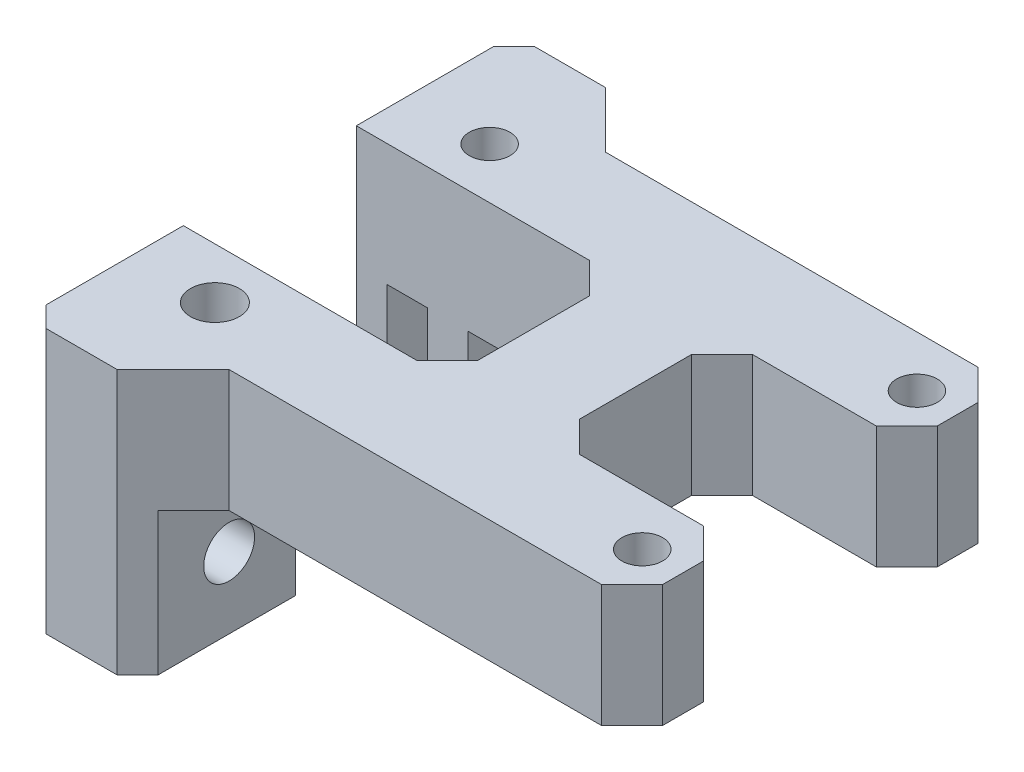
SolidWorks part; units mm, degrees
ref_plane "Front Plane" through (0, 0, 0) normal (0, 0, 1) x (1, 0, 0)
ref_plane "Top Plane" through (0, 0, 0) normal (0, 1, 0) x (1, 0, 0)
ref_plane "Right Plane" through (0, 0, 0) normal (1, 0, 0) x (0, 0, -1)
sketch "Sketch1" plane through (0, 0, 0) normal (0, 1, 0) x (1, 0, 0)
  line L0 (-9.58, 6.75) -> (9.58, 6.75) construction
  line L1 (9.58, 6.75) -> (9.58, -6.75) construction
  line L2 (0, 0) -> (50000, 0) construction
  line L3 (0, 0) -> (0, 50000) construction
  line L4 (-10.08, 4.25) -> (-4, 4.25)
  line L5 (-2.5, 2.75) -> (-2.5, -2.75)
  line L6 (-4, -4.25) -> (-10.08, -4.25)
  line L7 (10.08, 4.25) -> (4, 4.25)
  line L8 (2.5, 2.75) -> (2.5, -2.75)
  line L9 (4, -4.25) -> (10.08, -4.25)
  line L10 (-2.5, 0) -> (2.5, 0) construction
  line L11 (-10.08, 9.25) -> (10.08, 9.25)
  line L12 (-10.08, -9.25) -> (10.08, -9.25)
  line L13 (10.08, 9.25) -> (11.58, 7.75)
  line L14 (11.58, 7.75) -> (11.58, 5.75)
  line L15 (11.58, 5.75) -> (10.08, 4.25)
  line L16 (10.08, -4.25) -> (11.58, -5.75)
  line L17 (11.58, -5.75) -> (11.58, -7.75)
  line L18 (11.58, -7.75) -> (10.08, -9.25)
  line L19 (2.5, 2.75) -> (4, 4.25)
  line L20 (4, -4.25) -> (2.5, -2.75)
  line L21 (-4, -4.25) -> (-2.5, -2.75)
  line L22 (-4, 4.25) -> (-2.5, 2.75)
  line L23 (-11.58, 7.75) -> (-11.58, 5.75)
  line L24 (-11.58, -5.75) -> (-11.58, -7.75)
  line L25 (-11.58, 5.75) -> (-10.08, 4.25)
  line L26 (-11.58, -5.75) -> (-10.08, -4.25)
  line L27 (-11.58, 7.75) -> (-10.08, 9.25)
  line L28 (-11.58, -7.75) -> (-10.08, -9.25)
  circle A0 centre (-9.58, 6.75) radius 1 construction
  circle A1 centre (9.58, 6.75) radius 1 construction
  circle A2 centre (-9.58, -6.75) radius 1 construction
  circle A3 centre (9.58, -6.75) radius 1 construction
  circle A4 centre (9.58, 6.75) radius 1
  circle A5 centre (9.58, -6.75) radius 1
  point P13 (0, 6.75)
  point P14 (9.58, 0)
  point P25 (0, 0)
  point P30 (0, -9.25)
  point P31 (0, 9.25)
  dimension "D1" = 13.5
  dimension "D2" = 19.16
  dimension "D3" = 2
  dimension "D4" = 5
  dimension "D6" = 2.5
  dimension "D9" = 135
  dimension "D14" = 135
  dimension "D8" = 2
  dimension "D5" = 5
  dimension "D7" = 5
  dimension "D10" = 2
  dimension "D11" = 135
  dimension "D12" = 1.5
  dimension "D13" = 1.5
  dimension "D16" = 135
  dimension "D17" = 1.5
extrude "Boss-Extrude4" add sketch "Sketch1" along normal blind 6
sketch "Sketch11" plane through (0, 0, 0) normal (0, -1, 0) x (1, 0, 0)
  line L0 (-11.97, 10) -> (-11.97, -10) construction
  line L1 (-13.97, 10) -> (-13.97, -10) construction
  line L2 (-15.47, 10) -> (-15.47, -10) construction
  line L3 (-9.97, 10) -> (-9.97, -10) construction
  line L4 (-11.58, -7.75) -> (-11.58, -5.75) construction
  line L6 (0, 0) -> (-50000, 0) construction
  line L7 (-9.97, 4.25) -> (-11.97, 4.25)
  line L8 (-9.97, -4.25) -> (-11.97, -4.25)
  line L9 (-10.97, 4.25) -> (-10.97, -4.25) construction
  line L10 (-13.97, 10) -> (-11.97, 10)
  line L11 (-11.97, -10) -> (-13.97, -10)
  line L12 (-11.97, -4.25) -> (-11.97, -10)
  line L13 (-11.97, 10) -> (-11.97, 4.25)
  line L14 (-13.97, 10) -> (-13.97, 4.25)
  line L15 (-13.97, 4.25) -> (-15.47, 4.25)
  line L16 (-13.97, -10) -> (-13.97, -4.25)
  line L17 (-13.97, -4.25) -> (-15.47, -4.25)
  line L18 (-14.47, 12) -> (-10.97, 12)
  line L19 (-14.47, -12) -> (-10.97, -12)
  line L20 (-15.47, 11) -> (-15.47, 4.25)
  line L21 (-15.47, -4.25) -> (-15.47, -11)
  line L22 (-9.97, -4.25) -> (-9.97, -11)
  line L23 (-9.97, 11) -> (-9.97, 4.25)
  line L24 (-15.47, 11) -> (-14.47, 12)
  line L25 (-10.97, 12) -> (-9.97, 11)
  line L26 (-15.47, -11) -> (-14.47, -12)
  line L27 (-9.97, -11) -> (-10.97, -12)
  point P15 (-9.97, 0)
  point P16 (-11.97, 0)
  point P17 (-13.97, 0)
  point P18 (-15.47, 0)
  point P23 (-10.97, 0)
  dimension "D10" = 1.61
  dimension "D1" = 2
  dimension "D2" = 2
  dimension "D3" = 1.5
  dimension "D4" = 20
  dimension "D5" = 8.5
  dimension "D6" = 2
  dimension "D7" = 2
  dimension "D8" = 135
  dimension "D9" = 1
extrude "Boss-Extrude5" add sketch "Sketch11" along normal blind 7
sketch "Sketch12" plane through (0, 0, 0) normal (0, 1, 0) x (1, 0, 0)
  line L0 (-10.08, 4.25) -> (-15.47, 4.25)
  line L1 (-15.47, 4.25) -> (-15.47, 11)
  line L2 (-15.47, 11) -> (-14.47, 12)
  line L3 (-14.47, 12) -> (-10.97, 12)
  line L4 (-10.97, 12) -> (-8.22, 9.25)
  line L5 (10.08, 9.25) -> (-10.08, 9.25) construction
  line L6 (-10.08, 4.25) -> (-11.58, 5.75)
  line L7 (-11.58, 5.75) -> (-10.08, 4.25) construction
  line L8 (-11.58, 5.75) -> (-11.58, 7.75)
  line L9 (-11.58, 7.75) -> (-10.08, 9.25)
  line L10 (-10.08, 9.25) -> (-8.22, 9.25)
  line L11 (-15.47, -4.25) -> (-15.47, -11)
  line L12 (-15.47, -11) -> (-14.47, -12)
  line L13 (-14.47, -12) -> (-10.97, -12)
  line L14 (-10.97, -12) -> (-14.47, -12) construction
  line L15 (-10.97, -12) -> (-8.22, -9.25)
  line L16 (-10.08, -9.25) -> (10.08, -9.25) construction
  line L17 (-8.22, -9.25) -> (-10.08, -9.25)
  line L18 (-10.08, -9.25) -> (-11.58, -7.75)
  line L19 (-11.58, -7.75) -> (-11.58, -5.75)
  line L20 (-11.58, -5.75) -> (-10.08, -4.25)
  line L21 (-10.08, -4.25) -> (-11.58, -5.75) construction
  line L22 (-11.97, -4.25) -> (-10.08, -4.25) construction
  line L23 (-10.08, -4.25) -> (-15.47, -4.25)
extrude "Boss-Extrude6" add sketch "Sketch12" along normal up to surface (6 mm away)
sketch "Sketch13" plane through (-9.97, 0, 0) normal (1, 0, 0) x (0, 0, -1)
  line L0 (-4.25, -3.5) -> (49995.75, -3.5) construction
  line L1 (-4.25, -7) -> (-4.25, 0) construction
  line L2 (0, 0) -> (0, 50000) construction
  line L3 (-2.75, 0) -> (2.75, 0) construction
  line L4 (-7.5, -3.5) -> (7.5, -3.5) construction
  circle A0 centre (-7.5, -3.5) radius 1.25
  circle A1 centre (7.5, -3.5) radius 1.25
  point P4 (-4.25, -3.5)
  point P13 (0, 0)
  point P14 (0, -3.5)
  dimension "D1" = 2.5
  dimension "D2" = 15
extrude "Cut-Extrude6" cut sketch "Sketch13" against normal blind 2
sketch "Sketch14" plane through (-13.97, 0, 0) normal (1, 0, 0) x (0, 0, -1)
  circle A0 centre (-7.5, -3.5) radius 0.75
  circle A1 centre (7.5, -3.5) radius 0.75
  dimension "D1" = 1.5
extrude "Cut-Extrude7" cut sketch "Sketch14" against normal blind 2
sketch "Sketch15" plane through (0, 6, 0) normal (0, 1, 0) x (1, 0, 0)
  circle A0 centre (-11.42, 6.75) radius 1
  circle A1 centre (-11.42, -6.75) radius 1.2
  circle A2 centre (9.58, 6.75) radius 1 construction
  circle A3 centre (9.58, 6.75) radius 1 construction
  circle A4 centre (9.58, -6.75) radius 1 construction
  dimension "D1" = 21
  dimension "D2" = 2.4
extrude "Cut-Extrude8" cut sketch "Sketch15" against normal up to surface (6 mm away)
